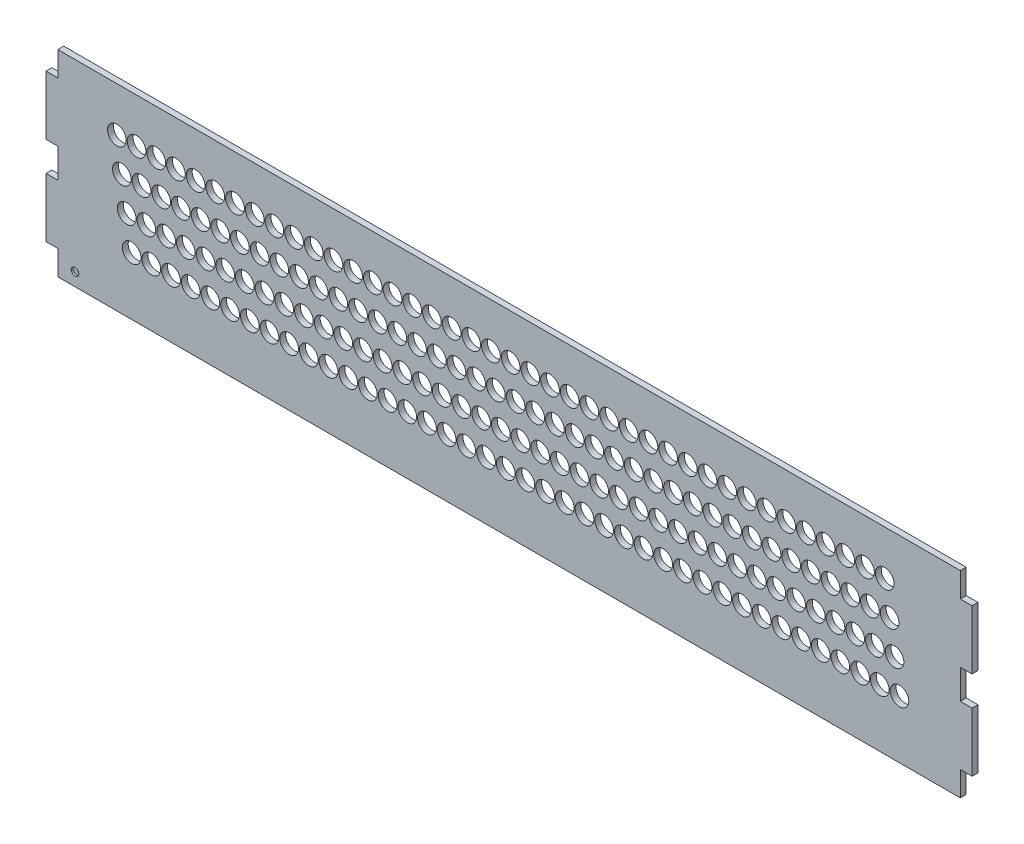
SolidWorks part; units mm, degrees
ref_plane "Alzado" through (0, 0, 0) normal (0, 0, 1) x (1, 0, 0)
ref_plane "Planta" through (0, 0, 0) normal (0, 1, 0) x (1, 0, 0)
ref_plane "Vista lateral" through (0, 0, 0) normal (1, 0, 0) x (0, 0, -1)
sketch "Croquis1" plane through (0, 0, 0) normal (0, 0, 1) x (1, 0, 0)
  line L1 (-229.2, -50) -> (229.2, -50)
  line L2 (-229.2, -50) -> (-229.2, 50)
  line L3 (-229.2, 50) -> (229.2, 50)
  line L4 (229.2, -50) -> (229.2, 50)
  line L5 (-229.2, -50) -> (229.2, 50) construction
  line L6 (-229.2, 50) -> (229.2, -50) construction
  point P0 (0, 0)
  dimension "D1" = 100
  dimension "D2" = 458.4
extrude "Saliente-Extruir1" add sketch "Croquis1" along normal blind 3
sketch "Croquis2" plane through (-229.2, 0, 0) normal (-1, 0, 0) x (0, 0, 1)
  line L0 (3, 50) -> (3, -50) construction
  line L1 (3, 37.5) -> (0, 37.5)
  line L2 (3, 37.5) -> (3, 7.5)
  line L3 (3, 7.5) -> (0, 7.5)
  line L4 (0, 37.5) -> (0, 7.5)
  line L5 (0, 50) -> (0, -50) construction
  line L6 (0, 7.5) -> (0, -7.5) construction
  line L7 (3, -7.5) -> (0, -7.5)
  line L8 (3, -7.5) -> (3, -37.5)
  line L9 (3, -37.5) -> (0, -37.5)
  line L10 (0, -7.5) -> (0, -37.5)
  point P12 (0, 0)
  point P13 (0, 22.5)
  point P15 (0, -22.5)
  dimension "D1" = 30
  dimension "D2" = 30
  dimension "D3" = 45
extrude "Saliente-Extruir2" add sketch "Croquis2" along normal blind 6
sketch "Croquis3" plane through (229.2, 0, 0) normal (1, 0, 0) x (0, 0, -1)
  line L0 (-3, -50) -> (-3, 50) construction
  line L1 (-3, -37.5) -> (0, -37.5)
  line L2 (-3, -37.5) -> (-3, -7.5)
  line L3 (-3, -7.5) -> (0, -7.5)
  line L4 (0, -37.5) -> (0, -7.5)
  line L5 (0, -50) -> (0, 50) construction
  line L6 (0, -7.5) -> (0, 7.5) construction
  line L7 (-3, 7.5) -> (0, 7.5)
  line L8 (-3, 7.5) -> (-3, 37.5)
  line L9 (-3, 37.5) -> (0, 37.5)
  line L10 (0, 7.5) -> (0, 37.5)
  point P12 (0, 0)
  point P13 (0, -22.5)
  point P15 (0, 22.5)
  dimension "D1" = 30
  dimension "D2" = 30
  dimension "D3" = 45
extrude "Saliente-Extruir3" add sketch "Croquis3" along normal blind 6
sketch "Croquis4" plane through (0, 0, 3) normal (0, 0, 1) x (1, 0, 0)
  line L0 (-229.2, 50) -> (-229.2, 37.5) construction
  line L1 (229.2, 50) -> (-229.2, 50) construction
  circle A0 centre (-199.2, 27.4) radius 4.75
  circle A1 centre (-196.7, 11.4) radius 4.75
  circle A2 centre (-194.2, -4.6) radius 4.75
  circle A3 centre (-191.7, -20.6) radius 4.75
  dimension "D1" = 9.5
  dimension "D2" = 9.5
  dimension "D3" = 9.5
  dimension "D4" = 9.5
  dimension "D7" = 2.5
  dimension "D8" = 16
  dimension "D9" = 2.5
  dimension "D10" = 16
  dimension "D11" = 16
  dimension "D12" = 2.5
  dimension "D5" = 30
  dimension "D6" = 22.6
extrude "Cortar-Extruir1" cut sketch "Croquis4" against normal up to next
pattern_linear "MatrizL1" count 40 spacing 10 along (1, 0, 0) of "Cortar-Extruir1"
sketch "Croquis5" plane through (0, 0, 3) normal (0, 0, 1) x (1, 0, 0)
  circle A0 centre (-220.4784, -43.3748) radius 1.9347
extrude "Cortar-Extruir2" cut sketch "Croquis5" against normal blind 1
